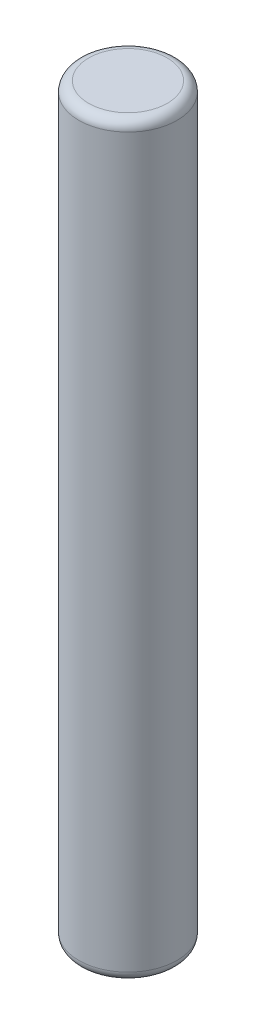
SolidWorks part; units mm, degrees
ref_plane "Спереди" through (0, 0, 0) normal (0, 0, 1) x (1, 0, 0)
ref_plane "Сверху" through (0, 0, 0) normal (0, 1, 0) x (1, 0, 0)
ref_plane "Справа" through (0, 0, 0) normal (1, 0, 0) x (0, 0, -1)
sketch "Эскиз1" plane through (0, 0, 0) normal (0, 1, 0) x (1, 0, 0)
  circle A0 centre (0, 0) radius 1.25
  dimension "D1" = 2.5
extrude "Бобышка-Вытянуть1" add sketch "Эскиз1" along normal mid plane 19
fillet "Скругление1" radius 0.25 2 edges at (0, -9.5, 1.25) (0, 9.5, 1.25)
